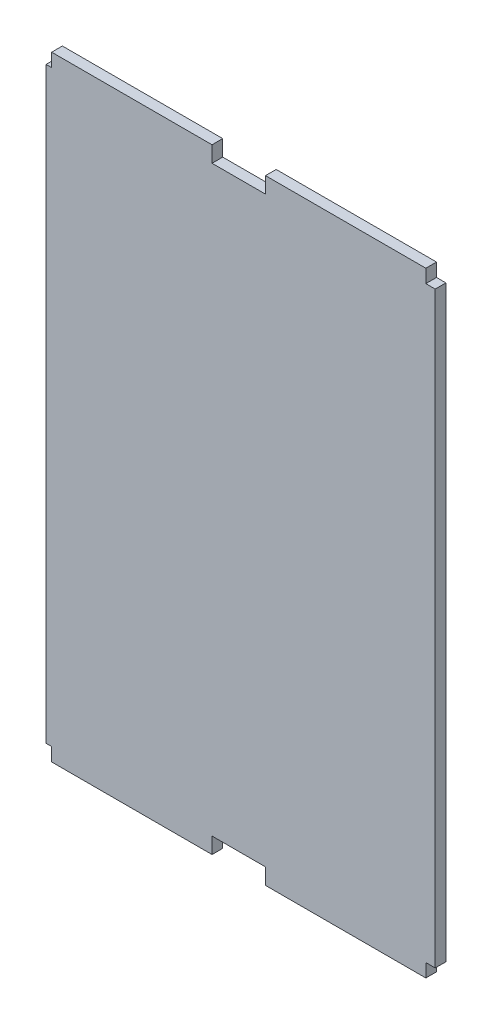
SolidWorks part; units mm, degrees
ref_plane "Front Plane" through (0, 0, 0) normal (0, 0, 1) x (1, 0, 0)
ref_plane "Top Plane" through (0, 0, 0) normal (0, 1, 0) x (1, 0, 0)
ref_plane "Right Plane" through (0, 0, 0) normal (1, 0, 0) x (0, 0, -1)
sketch "Croquis1" plane through (0, 0, 0) normal (0, 0, 1) x (1, 0, 0)
  line L0 (0, 0) -> (-144.7928, 0) construction
  line L2 (-45, -55) -> (-45, 55)
  line L4 (45, -55) -> (45, 55)
  line L5 (-45, -55) -> (45, 55) construction
  line L6 (-45, 55) -> (45, -55) construction
  line L37 (-45, -55) -> (-35, -55)
  line L38 (-35, -55) -> (-35, -57.5)
  line L39 (-35, -57.5) -> (-5, -57.5)
  line L40 (-5, -57.5) -> (-5, -54.5)
  line L41 (-5, -54.5) -> (5, -54.5)
  line L42 (5, -54.5) -> (5, -57.5)
  line L43 (5, -57.5) -> (35, -57.5)
  line L44 (35, -57.5) -> (35, -55)
  line L45 (35, -55) -> (45, -55)
  line L47 (35, 57.5) -> (35, 55)
  line L48 (5, 57.5) -> (35, 57.5)
  line L49 (5, 54.5) -> (5, 57.5)
  line L50 (35, 55) -> (45, 55)
  line L51 (-5, 57.5) -> (-5, 54.5)
  line L52 (-35, 57.5) -> (-5, 57.5)
  line L53 (-35, 55) -> (-35, 57.5)
  line L54 (-5, 54.5) -> (5, 54.5)
  line L55 (-45, 55) -> (-35, 55)
  point P0 (0, 0)
  dimension "D1" = 10
  dimension "D2" = 110
  dimension "D3" = 90
  dimension "D4" = 2.5
  dimension "D5" = 3
  dimension "D6" = 2.5
  dimension "D7" = 30
  dimension "D8" = 30
  dimension "D9" = 10
extrude "Saliente-Extruir1" add sketch "Croquis1" along normal blind 2
sketch "Croquis2" plane through (0, 0, 2) normal (0, 0, 1) x (1, 0, 0)
  line L0 (-45, -55) -> (-35, -55) construction
  line L1 (-45, 55) -> (-36.0427, 55)
  line L2 (-45, 55) -> (-45, -55)
  line L3 (-45, -55) -> (-36.0427, -55)
  line L4 (-36.0427, 55) -> (-36.0427, -55)
  line L6 (45, 55) -> (36.7522, 55)
  line L7 (45, 55) -> (45, -55)
  line L8 (45, -55) -> (36.7522, -55)
  line L9 (36.7522, 55) -> (36.7522, -55)
extrude "Cortar-Extruir1" cut sketch "Croquis2" against normal blind 3
